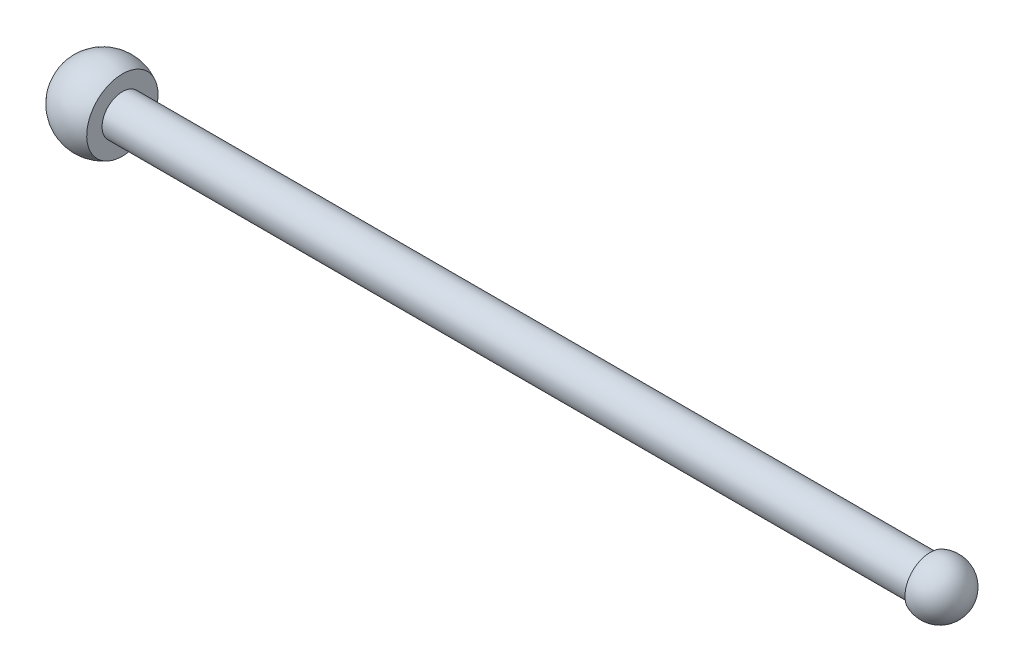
SolidWorks part; units mm, degrees
ref_plane "Front Plane" through (0, 0, 0) normal (0, 0, 1) x (1, 0, 0)
ref_plane "Top Plane" through (0, 0, 0) normal (0, 1, 0) x (1, 0, 0)
ref_plane "Right Plane" through (0, 0, 0) normal (1, 0, 0) x (0, 0, -1)
sketch "Sketch1" plane through (0, 0, 0) normal (0, 0, 1) x (1, 0, 0)
  line L0 (-211.5929, 0) -> (222.3436, 0) construction
  line L1 (-196.596, 9.525) -> (196.596, 9.525)
  line L2 (-196.596, 9.525) -> (-196.596, 0)
  line L3 (-196.596, 0) -> (196.596, 0)
  line L4 (196.596, 9.525) -> (196.596, 0)
  line L5 (0, 54.0136) -> (0, -48.6405) construction
  dimension "D1" = 393.192
  dimension "D2" = 9.525
revolve "Revolve1" add sketch "Sketch1" angle 360 about L0
sketch "Sketch2" plane through (0, 0, 0) normal (0, 0, 1) x (1, 0, 0)
  line L0 (0, 0) -> (245.4408, 0) construction
  line L1 (196.596, 9.525) -> (196.596, -17.3905) construction
  line L2 (196.596, -9.525) -> (196.596, 9.525) construction
  line L3 (192.0694, 0) -> (209.296, 0)
  line L4 (192.0694, 11.8659) -> (192.0694, 0)
  arc A0 (209.296, 0) -> (192.0694, 11.8659) centre (196.596, 0) ccw
  dimension "D1" = 25.4
revolve "Revolve2" add sketch "Sketch2" angle 360 about L0
sketch "Sketch3" plane through (0, 0, 0) normal (0, 0, 1) x (1, 0, 0)
  line L0 (-146.9747, 0) -> (-232.2114, 0) construction
  line L1 (-196.596, 9.525) -> (-196.596, -9.525) construction
  line L2 (-196.596, 9.525) -> (-196.596, -9.525) construction
  line L3 (-215.646, 0) -> (-187.5325, 0)
  line L4 (-187.5325, 16.7558) -> (-187.5325, 0)
  arc A0 (-187.5325, 16.7558) -> (-215.646, 0) centre (-196.596, 0) ccw
  dimension "D1" = 38.1
revolve "Revolve3" add sketch "Sketch3" angle 360 about L0
sketch "Sketch4" plane through (192.0694, 0, 0) normal (-1, 0, 0) x (0, 0, 1)
  line L1 (0, 0) -> (20.1196, 0)
  line L2 (0, 0) -> (0, 13.1318)
  line L3 (0, 13.1318) -> (20.1196, 13.1318)
  line L4 (20.1196, 0) -> (20.1196, 13.1318)
  circle A0 centre (0, 0) radius 11.8659 construction
